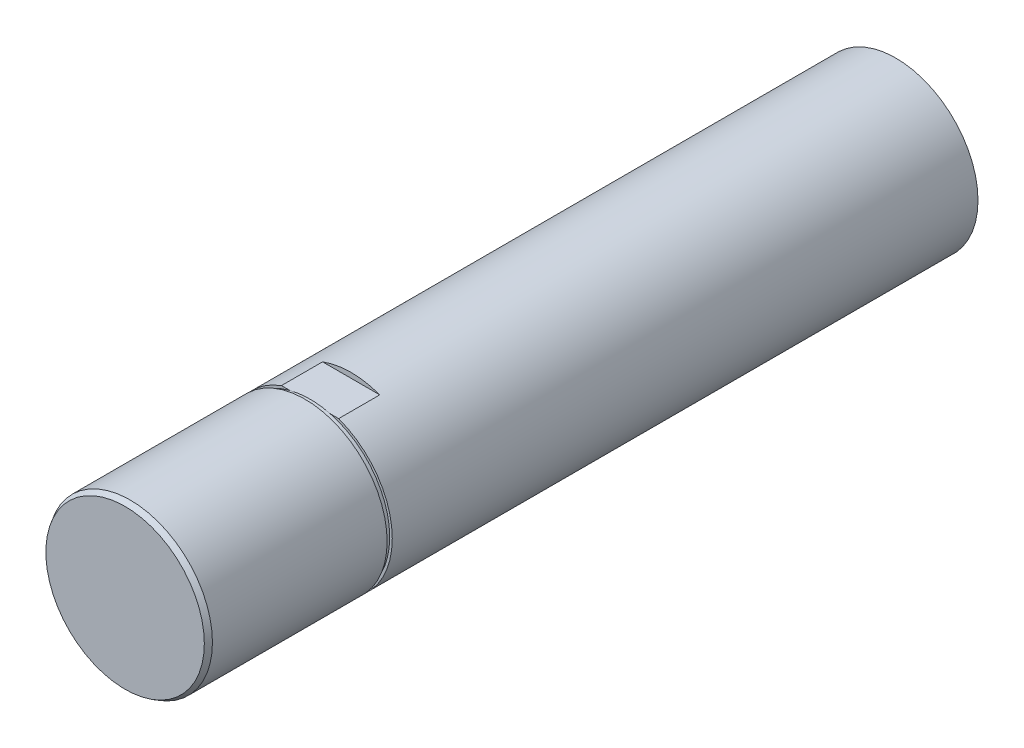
SolidWorks part; units mm, degrees
ref_plane "Front Plane" through (0, 0, 0) normal (0, 0, 1) x (1, 0, 0)
ref_plane "Top Plane" through (0, 0, 0) normal (0, 1, 0) x (1, 0, 0)
ref_plane "Right Plane" through (0, 0, 0) normal (1, 0, 0) x (0, 0, -1)
sketch "Sketch1" plane through (0, 0, 0) normal (0, 0, 1) x (1, 0, 0)
  circle A0 centre (0, 0) radius 16
  dimension "D1" = 32
extrude "STROKE" add sketch "Sketch1" against normal blind 100
sketch "Sketch2" plane through (0, 0, 0) normal (0, 0, 1) x (1, 0, 0)
  circle A0 centre (0, 0) radius 16
  dimension "D1" = 32
extrude "L2" add sketch "Sketch2" along normal blind 14
ref_plane "Plane1" through (0, 0, 14) normal (0, 0, 1) x (1, 0, 0)
sketch "Sketch3" plane through (0, 0, 14) normal (0, 0, 1) x (1, 0, 0)
  circle A0 centre (0, 0) radius 16
  dimension "D1" = 32
extrude "L3" add sketch "Sketch3" along normal blind 36
chamfer "Chamfer2" distance 1 angle 30 1 edges at (16, 0, 50)
sketch "Sketch5" plane through (0, 0, 14) normal (0, 0, 1) x (1, 0, 0)
  circle A0 centre (0, 0) radius 16
  circle A1 centre (0, 0) radius 15.5
  circle A4 centre (0, 0) radius 16 construction
  dimension "D1" = 32
  dimension "D2" = 31
extrude "U/C" cut sketch "Sketch5" along normal blind 1
sketch "Sketch6" plane through (0, 0, 0) normal (1, 0, 0) x (0, 0, -1)
  line L0 (-50, 15.4226) -> (-50, -15.4226) construction
  line L1 (-14, 16.5) -> (-6, 16.5)
  line L2 (-14, -15) -> (-14, -16.5)
  line L3 (-14, 15) -> (-6, 15)
  line L4 (-6, 16.5) -> (-6, 15)
  line L5 (-14, -15) -> (-6, -15)
  line L6 (-14, 16.5) -> (-14, 15)
  line L7 (-14, -16.5) -> (-6, -16.5)
  line L8 (-6, -15) -> (-6, -16.5)
  line L9 (100, -16) -> (100, 16) construction
  line L10 (100, 0) -> (-14, 0) construction
  line L12 (100, 0) -> (-14, 0) construction
  dimension "D1" = 8
  dimension "D2" = 30
  dimension "D3" = 15
  dimension "D4" = 36
  dimension "D5" = 33
  dimension "D6" = 32
  dimension "D7" = 16.5
extrude "A/F" cut sketch "Sketch6" against normal mid plane 21
equation "\"D2@Sketch5\" = \"D1@Sketch5\" - 1"
equation "\"D5@Sketch6\" = \"D2@Sketch6\"+3"
equation "\"D3@Sketch6\" = \"D2@Sketch6\" / 2"
equation "\"D2@Sketch6\" = \"D6@Sketch6\"-2"
equation "\"D7@Sketch6\" = \"D5@Sketch6\"/2"
